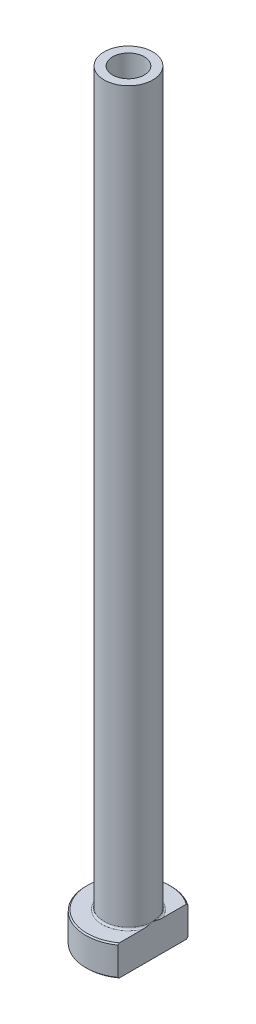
SolidWorks part; units mm, degrees
ref_plane "Front Plane" through (0, 0, 0) normal (0, 0, 1) x (1, 0, 0)
ref_plane "Top Plane" through (0, 0, 0) normal (0, 1, 0) x (1, 0, 0)
ref_plane "Right Plane" through (0, 0, 0) normal (1, 0, 0) x (0, 0, -1)
sketch "Sketch1" plane through (0, 0, 0) normal (0, 0, 1) x (1, 0, 0)
  line L0 (-2.6, 125) -> (-4, 125)
  line L1 (-4, 125) -> (-4, 5)
  line L2 (-4, 5) -> (-7, 5)
  line L3 (-7, 5) -> (-7, 0)
  line L4 (6.05, 0) -> (-6.05, 0) construction
  line L5 (-7, 0) -> (-2.85, 0)
  line L6 (-2.6, 80) -> (-2.6, 125)
  line L7 (0, 92.1877) -> (0, -15.5353) construction
  line L8 (0, -7.7) -> (0, 7.7) construction
  line L9 (-2.6, 80) -> (-2.85, 68)
  line L10 (-2.85, 68) -> (-2.85, 0)
  dimension "D1" = 0.25
  dimension "ID" = 5.2
  dimension "OD" = 8
  dimension "L" = 125
  dimension "H" = 14
  dimension "T" = 5
  dimension "N" = 45
  dimension "D2" = 12
  dimension "L-N" = 80
revolve "Revolve1" add sketch "Sketch1" angle 360 about L7
fillet "Fillet1" radius 0.3 1 edges at (0, 5, 4)
chamfer "Chamfer1" distance 0.2 angle 45 2 edges at (0, 5, 7) (0, 0, 7)
sketch "Sketch2" plane through (0, 0, 0) normal (0, -1, 0) x (1, 0, 0)
  line L0 (4, 5.7446) -> (4, -5.7446)
  circle A0 centre (0, 0) radius 7 construction
  arc A1 (4, 5.7446) -> (4, -5.7446) centre (0, 0) cw
  circle A2 centre (0, 0) radius 4 construction
extrude "Cut-Extrude1" cut sketch "Sketch2" against normal through all
chamfer "Chamfer2" distance 0.5 angle 45 1 edges at (0, 0, 2.85)
